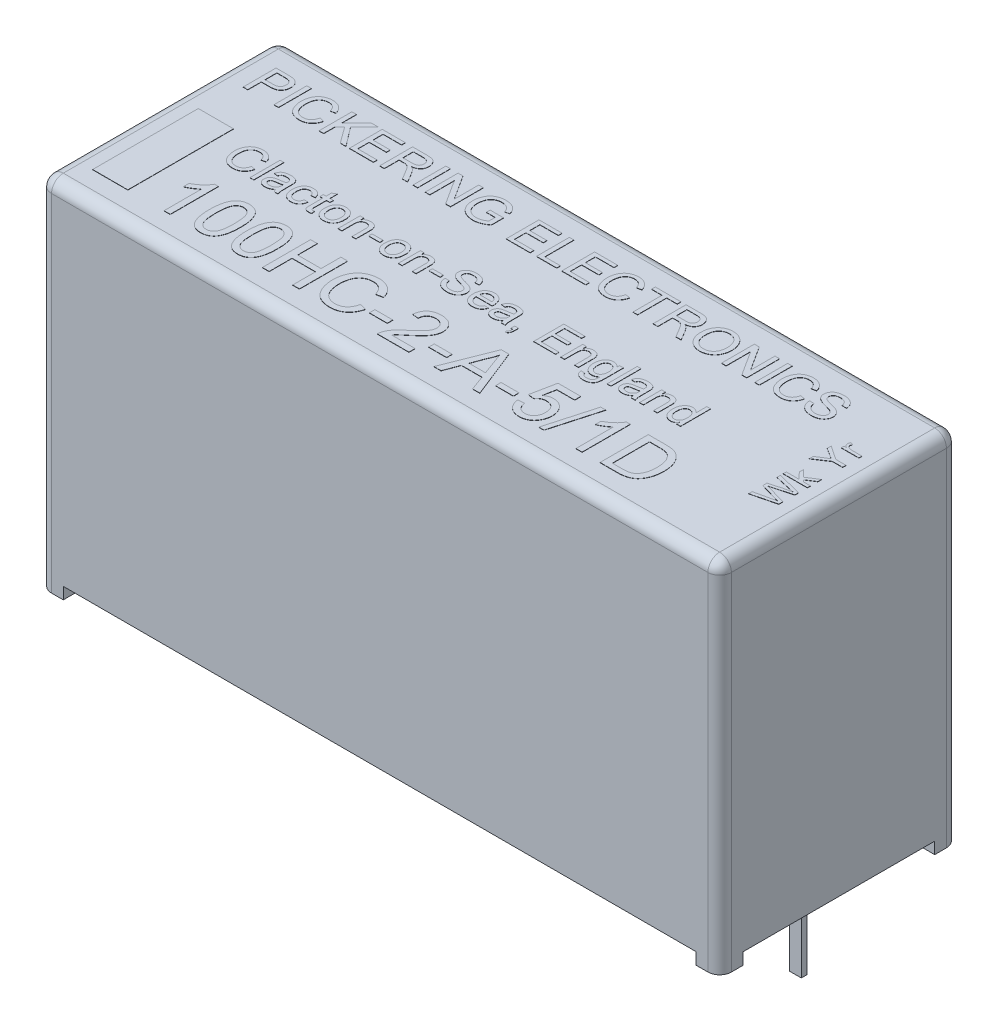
SolidWorks part; units mm, degrees
ref_plane "Front Plane" through (0, 0, 0) normal (0, 0, 1) x (1, 0, 0)
ref_plane "Top Plane" through (0, 0, 0) normal (0, 1, 0) x (1, 0, 0)
ref_plane "Right Plane" through (0, 0, 0) normal (1, 0, 0) x (0, 0, -1)
sketch "Sketch1" plane through (0, 0, 0) normal (0, 1, 0) x (1, 0, 0)
  line L1 (-14.478, -5.08) -> (14.478, -5.08)
  line L2 (-14.478, -5.08) -> (-14.478, 5.08)
  line L3 (-14.478, 5.08) -> (14.478, 5.08)
  line L4 (14.478, -5.08) -> (14.478, 5.08)
  line L5 (-14.478, -5.08) -> (14.478, 5.08) construction
  line L6 (-14.478, 5.08) -> (14.478, -5.08) construction
  point P0 (0, 0)
  dimension "D1" = 28.956
  dimension "D2" = 10.16
extrude "Boss-Extrude1" add sketch "Sketch1" along normal blind 15.24
sketch "Sketch2" plane through (0, 0, 5.08) normal (0, 0, 1) x (1, 0, 0)
  line L0 (-14.478, 0) -> (14.478, 0) construction
  line L1 (-13.478, 0) -> (13.478, 0)
  line L2 (-13.478, 0) -> (-13.478, 0.5)
  line L3 (-13.478, 0.5) -> (13.478, 0.5)
  line L4 (13.478, 0) -> (13.478, 0.5)
  line L5 (-14.478, 15.24) -> (-14.478, 0) construction
  line L6 (14.478, 15.24) -> (14.478, 0) construction
  dimension "D1" = 1
  dimension "D2" = 1
  dimension "D3" = 0.5
extrude "Cut-Extrude1" cut sketch "Sketch2" against normal through all
sketch "Sketch3" plane through (14.478, 0, 0) normal (1, 0, 0) x (0, 0, -1)
  line L0 (-5.08, 0) -> (5.08, 0) construction
  line L1 (-4.08, 0) -> (4.08, 0)
  line L2 (-4.08, 0) -> (-4.08, 0.5)
  line L3 (-4.08, 0.5) -> (4.08, 0.5)
  line L4 (4.08, 0) -> (4.08, 0.5)
  line L5 (-5.08, 15.24) -> (-5.08, 0) construction
  line L6 (5.08, 15.24) -> (5.08, 0) construction
  dimension "D1" = 1
  dimension "D2" = 1
  dimension "D3" = 0.5
extrude "Cut-Extrude2" cut sketch "Sketch3" against normal through all
sketch "Sketch4" plane through (0, 0.5, 0) normal (0, -1, 0) x (1, 0, 0)
  line L0 (-14.478, 0) -> (14.478, 0) construction
  line L1 (-14.478, -4.08) -> (-14.478, 4.08) construction
  line L2 (14.478, -4.08) -> (14.478, 4.08) construction
  line L4 (13.478, 5.08) -> (-13.478, 5.08) construction
  line L5 (0, 5.08) -> (0, -5.08) construction
  line L6 (13.478, -5.08) -> (-13.478, -5.08) construction
  line L7 (-2.8, -0.125) -> (-2.3, -0.125)
  line L8 (-2.8, -0.125) -> (-2.8, 0.125)
  line L9 (-2.8, 0.125) -> (-2.3, 0.125)
  line L10 (-2.3, -0.125) -> (-2.3, 0.125)
  line L11 (-2.8, -0.125) -> (-2.3, 0.125) construction
  line L12 (-2.8, 0.125) -> (-2.3, -0.125) construction
  line L13 (-7.9, -0.125) -> (-7.4, -0.125)
  line L14 (-7.9, -0.125) -> (-7.9, 0.125)
  line L15 (-7.9, 0.125) -> (-7.4, 0.125)
  line L16 (-7.4, -0.125) -> (-7.4, 0.125)
  line L17 (-7.9, -0.125) -> (-7.4, 0.125) construction
  line L18 (-7.9, 0.125) -> (-7.4, -0.125) construction
  line L19 (2.3, -0.125) -> (2.8, -0.125)
  line L20 (2.3, -0.125) -> (2.3, 0.125)
  line L21 (2.3, 0.125) -> (2.8, 0.125)
  line L22 (2.8, -0.125) -> (2.8, 0.125)
  line L23 (2.3, -0.125) -> (2.8, 0.125) construction
  line L24 (2.3, 0.125) -> (2.8, -0.125) construction
  line L25 (7.4, -0.125) -> (7.9, -0.125)
  line L26 (7.4, -0.125) -> (7.4, 0.125)
  line L27 (7.4, 0.125) -> (7.9, 0.125)
  line L28 (7.9, -0.125) -> (7.9, 0.125)
  line L29 (7.4, -0.125) -> (7.9, 0.125) construction
  line L30 (7.4, 0.125) -> (7.9, -0.125) construction
  line L31 (12.5, -0.125) -> (13, -0.125)
  line L32 (12.5, -0.125) -> (12.5, 0.125)
  line L33 (12.5, 0.125) -> (13, 0.125)
  line L34 (13, -0.125) -> (13, 0.125)
  line L35 (12.5, -0.125) -> (13, 0.125) construction
  line L36 (12.5, 0.125) -> (13, -0.125) construction
  line L37 (-13, -0.125) -> (-12.5, -0.125)
  line L38 (-13, -0.125) -> (-13, 0.125)
  line L39 (-13, 0.125) -> (-12.5, 0.125)
  line L40 (-12.5, -0.125) -> (-12.5, 0.125)
  line L41 (-13, -0.125) -> (-12.5, 0.125) construction
  line L42 (-13, 0.125) -> (-12.5, -0.125) construction
  point P6 (-2.55, 0)
  point P17 (-7.65, 0)
  point P22 (2.55, 0)
  point P27 (7.65, 0)
  point P32 (12.75, 0)
  point P37 (-12.75, 0)
  dimension "D1" = 5.1
  dimension "D2" = 5.1
  dimension "D3" = 5.1
  dimension "D4" = 0.5
  dimension "D5" = 0.25
  dimension "D6" = 5.1
  dimension "D7" = 5.1
extrude "Boss-Extrude2" add sketch "Sketch4" along normal blind 3.6854 separate body
fillet "Fillet2" radius 0.5 4 edges at (0, 15.24, 5.08) (-14.478, 15.24, 0) (0, 15.24, -5.08) (14.478, 15.24, 0)
fillet "Fillet3" radius 0.5 8 edges at (-14.3316, 15.0936, -4.9336) (14.3316, 15.0936, -4.9336) (14.3316, 15.0936, 4.9336) (-14.3316, 15.0936, 4.9336) (-14.478, 7.37, -5.08) (14.478, 7.37, -5.08) (14.478, 7.37, 5.08) (-14.478, 7.37, 5.08)
sketch "Sketch5" plane through (0, 15.24, 0) normal (0, 1, 0) x (1, 0, 0)
  line L0 (-13.478, 2.42) -> (10.7486, 2.42) construction
  line L1 (-11.228, -0.78) -> (8.6555, -0.78) construction
  line L2 (-11.228, -3.83) -> (12.0348, -3.83) construction
  line L3 (13.978, -5.08) -> (-13.978, -5.08) construction
  line L4 (-13.478, 0.67) -> (-11.978, 0.67)
  line L5 (-13.478, 0.67) -> (-13.478, -3.83)
  line L6 (-13.478, -3.83) -> (-11.978, -3.83)
  line L7 (-11.978, 0.67) -> (-11.978, -3.83)
  line L8 (-14.478, -4.58) -> (-14.478, 4.58) construction
  line L9 (13.478, -1.83) -> (13.478, 2.742) construction
  line L10 (14.478, 4.58) -> (14.478, -4.58) construction
  text T0 "PICKERING ELECTRONICS" font "Arial" height 1.4
  text T1 "Clacton-on-Sea, England" font "Arial" height in points 5
  text T2 "100HC-2-A-5/1D" font "Arial" height in points 8
  text T3 "Wk Yr" font "Arial" height in points 4
  dimension "D1" = 4.5
  dimension "D2" = 1.5
  dimension "D3" = 1.25
  dimension "D4" = 1
  dimension "D5" = 1.25
  dimension "D6" = 4.3
  dimension "D7" = 7.5
  dimension "D8" = 3.25
  dimension "D9" = 3.25
  dimension "D10" = 3.25
  dimension "D11" = 1
extrude "Print Details" add sketch "Sketch5" along normal blind 0.01 separate body
equation "\"1.251.20mm\"=1.2"
